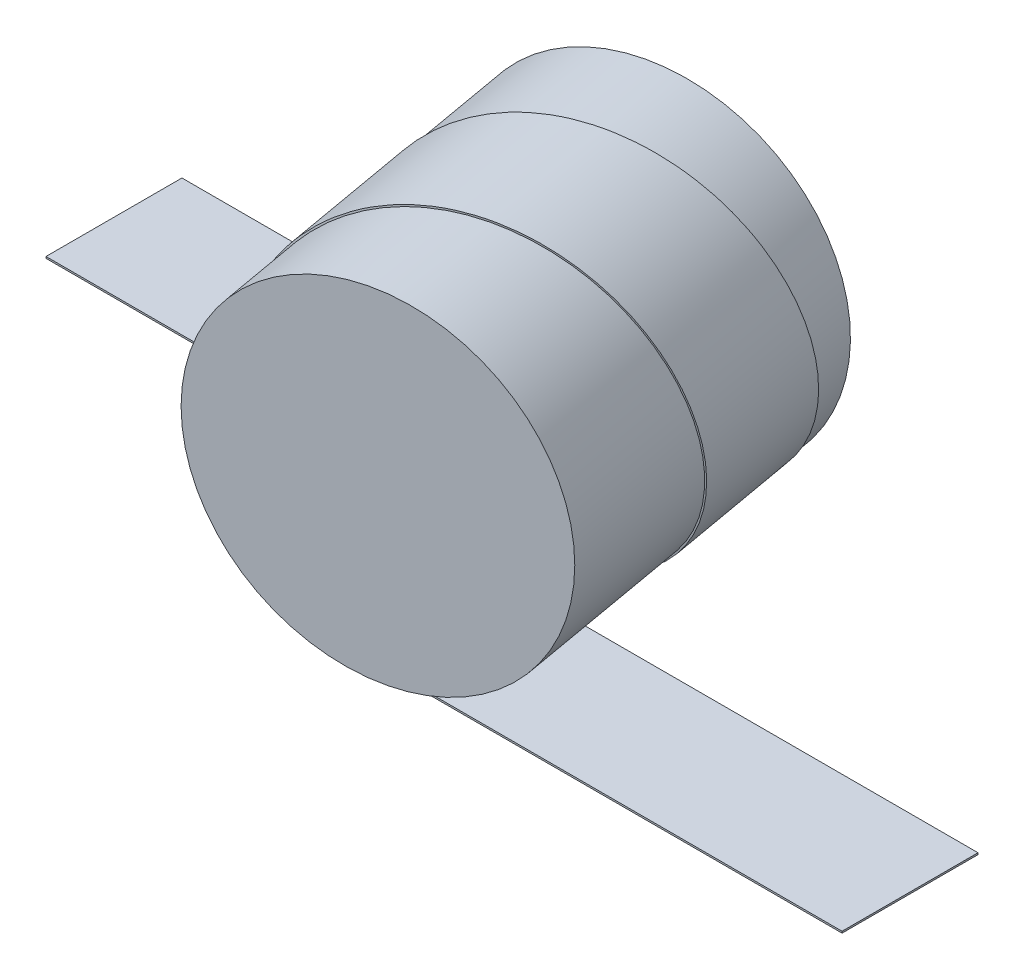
SolidWorks part; units mm, degrees
ref_plane "Vorderansicht" through (0, 0, 0) normal (0, 0, 1) x (1, 0, 0)
ref_plane "Draufsicht" through (0, 0, 0) normal (0, 1, 0) x (1, 0, 0)
ref_plane "Seitenansicht" through (0, 0, 0) normal (1, 0, 0) x (0, 0, -1)
sketch "Skizze1" plane through (0, 0, 0) normal (0, 1, 0) x (1, 0, 0)
  line L0 (-55.5528, 0) -> (55.5528, 0) construction
  line L1 (600, 20) -> (0, 20)
  line L2 (600, 20) -> (600, -20)
  line L3 (600, -20) -> (0, -20)
  line L4 (0, 20) -> (0, -20)
  line L5 (600, 20) -> (0, -20) construction
  line L6 (600, -20) -> (0, 20) construction
  line L7 (0, -22) -> (0, 22) construction
  point P0 (300, 0)
  dimension "D1" = 40
  dimension "D2" = 600
sheet metal parameters "Blech1" thickness 0.5 parameters "D1"=0.7366, "Dicke"=0.5
base flange "Basis-Blech1" sketch "Skizze1" thickness 0.5 reverse thickness direction yes parameters "D1"=0.7366
sketch "Skizze11" plane through (0, 0.5, 0) normal (0, 1, 0) x (1, 0, 0)
  line L0 (300, 20) -> (307.0531, -20)
  line L1 (600, 20) -> (0, 20) construction
  line L2 (-55.5528, 0) -> (55.5528, 0) construction
  line L3 (0, -22) -> (0, 22) construction
  line L4 (0, -20) -> (600, -20) construction
  dimension "D1" = 80
  dimension "D2" = 300
sketched bend "Skizzierte Biegung8" parameters "D1"=50
bend "Skizzenbiegung8" bend radius 50 bend angle 360 parameters "D5"=3
ref_plane "Ebene1" through (0, 101, 0) normal (0, 1, 0) x (-1, 0, 0)
ref_plane "Ebene2" through (0, 50.5, 0) normal (0, 1, 0) x (-1, 0, 0)
sketch "Skizze12" plane through (0, 50.5, 0) normal (0, 1, 0) x (-1, 0, 0)
  line L0 (-200.2337, 32.4877) -> (-189.6273, -27.6641) construction
  line L1 (-106.1151, 80.3505) -> (-90.1617, -10.1256) construction
  line L2 (-167.791, 139.3138) -> (-139.8945, -18.8948) construction
  line L3 (-198.9023, 24.9373) -> (-191.8493, -15.0627) construction
  line L4 (-97.2173, 29.8887) -> (-104.2704, 69.8887) construction
  line L5 (-189.6273, -27.6641) -> (-90.1617, -10.1256) construction
  point P1 (-139.8945, -18.8948)
  dimension "D1" = 101
ref_plane "Ebene3" through (139.8945, 50.5, -18.8948) normal (-0.1736, 0, -0.9848) x (-0.9848, 0, 0.1736)
sketch "Skizze13" plane through (139.8945, 50.5, -18.8948) normal (-0.1736, 0, -0.9848) x (-0.9848, 0, 0.1736)
  line L0 (-50.5, 0) -> (50.5, 0) construction
  circle A0 centre (0, 0) radius 50
  dimension "D1" = 100
extrude "Linear austragen1" add sketch "Skizze13" against normal blind 100
flat pattern "Abwicklung1" parameters "halbeBahnbreite"=20, "1-Bogen"=69.9798
sketch "Biegung-Linien1" plane through (0, 0.5, 0) normal (0, 1, 0) x (-1, 0, 0)
bend of the flat pattern "Abwickeln-<Skizzenbiegung8>1"
